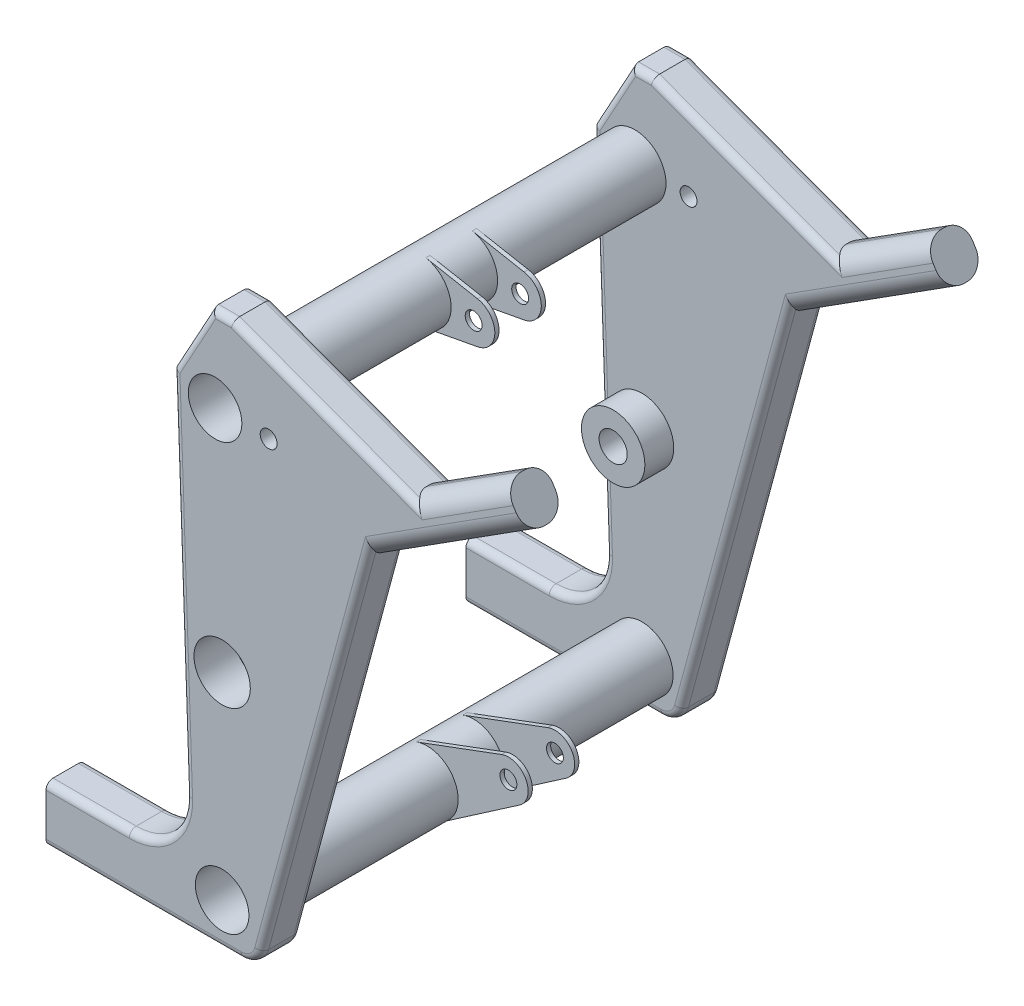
SolidWorks part; units mm, degrees
ref_plane "Plan de face" through (0, 0, 0) normal (0, 0, 1) x (1, 0, 0)
ref_plane "Plan de dessus" through (0, 0, 0) normal (0, 1, 0) x (1, 0, 0)
ref_plane "Plan de droite" through (0, 0, 0) normal (1, 0, 0) x (0, 0, -1)
sketch "Esquisse1" plane through (0, 0, 0) normal (0, 0, 1) x (1, 0, 0)
  circle A0 centre (0, 0) radius 10
  circle A1 centre (0, 0) radius 22.5
  dimension "D2" = 20
  dimension "D1" = 45
extrude "Extrusion1" add sketch "Esquisse1" along normal mid plane 271
sketch "Esquisse2" plane through (0, 0, 0) normal (0, 0, 1) x (1, 0, 0)
  line L0 (0, 0) -> (0, -121.4058) construction
  circle A0 centre (0, -140) radius 19
  circle A1 centre (0, -140) radius 22
  dimension "D2" = 38
  dimension "D3" = 140
  dimension "D1" = 3
extrude "Extrusion2" add sketch "Esquisse2" along normal mid plane 270
sketch "Esquisse3" plane through (0, 0, 0) normal (0, 0, 1) x (1, 0, 0)
  line L0 (0, 0) -> (0, 245.5219) construction
  circle A0 centre (-5, 159.9219) radius 19
  circle A1 centre (-5, 159.9219) radius 22
  dimension "D2" = 38
  dimension "D4" = 5
  dimension "D3" = 160
  dimension "D1" = 3
extrude "Extrusion3" add sketch "Esquisse3" along normal mid plane 270
ref_plane "Plan1" through (0, 0, 15) normal (0, 0, 1) x (1, 0, 0)
sketch "Esquisse6" plane through (0, 0, 15) normal (0, 0, 1) x (1, 0, 0)
  line L0 (35.7632, 174.6652) -> (-0.9474, 181.5454)
  line L1 (-0.9474, 138.2983) -> (35.7632, 145.1786)
  line L2 (-5, 159.9219) -> (185.0968, 159.9219) construction
  circle A0 centre (33, 159.9219) radius 6
  arc A1 (35.7632, 145.1786) -> (35.7632, 174.6652) centre (33, 159.9219) ccw
  circle A2 centre (-5, 159.9219) radius 22 construction
  circle A3 centre (33, 159.9219) radius 15 construction
  arc A4 (-0.9474, 181.5454) -> (-0.9474, 138.2983) centre (-5, 159.9219) ccw
  circle A5 centre (-5, 159.9219) radius 19 construction
  circle A6 centre (-5, 159.9219) radius 19
  dimension "D2" = 30
  dimension "D3" = 38
  dimension "D1" = 12
extrude "Extrusion4" add sketch "Esquisse6" along normal blind 3
pattern_linear "Répétition linéaire1" count 2 spacing 33 along (0, 0, -1) of "Extrusion4"
sketch "Esquisse7" plane through (0, 0, 15) normal (0, 0, 1) x (1, 0, 0)
  line L0 (-7.6746, -119.382) -> (52.779, -96.8795)
  line L1 (12.4787, -158.1186) -> (65.6038, -121.53)
  circle A0 centre (57.6628, -110) radius 6
  arc A1 (65.6038, -121.53) -> (52.779, -96.8795) centre (57.6628, -110) ccw
  circle A2 centre (0, -140) radius 22 construction
  arc A3 (-7.6746, -119.382) -> (12.4787, -158.1186) centre (0, -140) ccw
  circle A4 centre (0, -140) radius 19 construction
  circle A5 centre (0, -140) radius 19
  circle A6 centre (57.6628, -110) radius 14 construction
  dimension "D1" = 12
  dimension "D3" = 65
  dimension "D4" = 30
  dimension "D2" = 8
extrude "Extrusion5" add sketch "Esquisse7" along normal blind 3
pattern_linear "Répétition linéaire2" count 2 spacing 33 along (0, 0, -1) of "Extrusion5"
sketch "Esquisse8" plane through (0, 0, 0) normal (0, 0, 1) x (1, 0, 0)
  circle A0 centre (0, 0) radius 22.5 construction
  circle A1 centre (0, 0) radius 22.5
extrude "Enlèv. mat.-Extru.1" cut sketch "Esquisse8" against normal blind 114 and the other way blind 114
sketch "Esquisse9" plane through (0, 0, 135.5) normal (0, 0, 1) x (1, 0, 0)
  line L0 (-35, 169.8172) -> (-24.5302, -130)
  line L1 (-24.5302, -130) -> (-125, -130)
  line L2 (-125, -130) -> (-125, -170)
  line L3 (-125, -170) -> (25, -170)
  line L4 (25, -170) -> (103, 119.6826)
  line L5 (132.0439, 173.7173) -> (7.5, 219.9219)
  line L6 (7.5, 219.9219) -> (-7.5, 219.9219)
  line L7 (-7.5, 219.9219) -> (-35, 169.8172)
  line L8 (-138.0275, 0) -> (241.8351, 0) construction
  line L9 (0, 0) -> (0, 295.7003) construction
  line L10 (132.0439, 173.7173) -> (199.5415, 216.66)
  line L11 (199.5415, 216.66) -> (215.645, 191.3483)
  line L12 (215.645, 191.3483) -> (103, 119.6826)
  circle A0 centre (-5, 159.9219) radius 19 construction
  circle A1 centre (-5, 159.9219) radius 19
  circle A2 centre (0, 0) radius 10 construction
  circle A3 centre (0, 0) radius 10
  circle A4 centre (0, -140) radius 19 construction
  circle A5 centre (0, -140) radius 19
  circle A6 centre (33, 159.9219) radius 6 construction
  circle A7 centre (33, 159.9219) radius 6
  dimension "D2" = 40
  dimension "D3" = 170
  dimension "D4" = 25
  dimension "D5" = 150
  dimension "D6" = 70
  dimension "D7" = 360
  dimension "D8" = 300
  dimension "D9" = 30
  dimension "D10" = 15
  dimension "D11" = 60
  dimension "D12" = 7.5
  dimension "D13" = 2
  dimension "D14" = 30
  dimension "D15" = 100
  dimension "D16" = 80
  dimension "D17" = 300
extrude "Extrusion6" add sketch "Esquisse9" along normal blind 28
pattern_linear "Répétition linéaire3" count 2 spacing 298 along (0, 0, -1) of "Extrusion6"
sketch "Esquisse10" plane through (0, 0, 163.5) normal (0, 0, 1) x (1, 0, 0)
  circle A1 centre (0, 0) radius 10 construction
  circle A3 centre (0, 0) radius 20
  dimension "D1" = 40
extrude "Enlèv. mat.-Extru.2" cut sketch "Esquisse10" against normal blind 28
sketch "Esquisse11" plane through (0, 0, -162.5) normal (0, 0, -1) x (-1, 0, 0)
  circle A0 centre (0, 0) radius 22.5
  circle A1 centre (0, 0) radius 22.5 construction
extrude "Enlèv. mat.-Extru.3" cut sketch "Esquisse11" against normal blind 28
fillet "Congé1" radius 13 4 edges at (159.3225, 155.5155, 163.5) (165.7927, 195.1887, 135.5) (165.7927, 195.1887, 163.5) (159.3225, 155.5155, 135.5)
fillet "Congé2" radius 13 4 edges at (165.7927, 195.1887, -162.5) (159.3225, 155.5155, -162.5) (165.7927, 195.1887, -134.5) (159.3225, 155.5155, -134.5)
fillet "Congé4" radius 15 1 edges at (25, -170, 149.5)
fillet "Congé5" radius 15 1 edges at (25, -170, -148.5)
fillet "Congé6" radius 40 1 edges at (-24.5302, -130, 149.5)
fillet "Congé3" radius 5 18 edges at (-55.7477, -170, 135.5) (-30.4879, 40.6066, 135.5) (-21.25, 194.8696, 135.5) (-55.7477, -170, 163.5) (-95.4757, -130, 135.5) (-95.4757, -130, 163.5) (-30.4879, 40.6066, 163.5) (-21.25, 194.8696, 163.5) (0, 219.9219, 135.5) (0, 219.9219, 163.5) (77.4208, 193.9819, 135.5) (77.4208, 193.9819, 163.5) (67.9976, -10.3122, 135.5) (67.9976, -10.3122, 163.5) (-37.1778, -117.7863, 135.5) (-37.1778, -117.7863, 163.5) (22.6288, -166.9059, 135.5) (22.6288, -166.9059, 163.5)
fillet "Congé7" radius 40 1 edges at (-24.5302, -130, -148.5)
fillet "Congé8" radius 5 18 edges at (67.9976, -10.3122, -162.5) (22.6288, -166.9059, -162.5) (-95.4757, -130, -162.5) (-37.1778, -117.7863, -162.5) (-55.7477, -170, -162.5) (-30.4879, 40.6066, -162.5) (-21.25, 194.8696, -162.5) (0, 219.9219, -162.5) (77.4208, 193.9819, -162.5) (67.9976, -10.3122, -134.5) (22.6288, -166.9059, -134.5) (-30.4879, 40.6066, -134.5) (-37.1778, -117.7863, -134.5) (77.4208, 193.9819, -134.5) (0, 219.9219, -134.5) (-55.7477, -170, -134.5) (-21.25, 194.8696, -134.5) (-95.4757, -130, -134.5)
